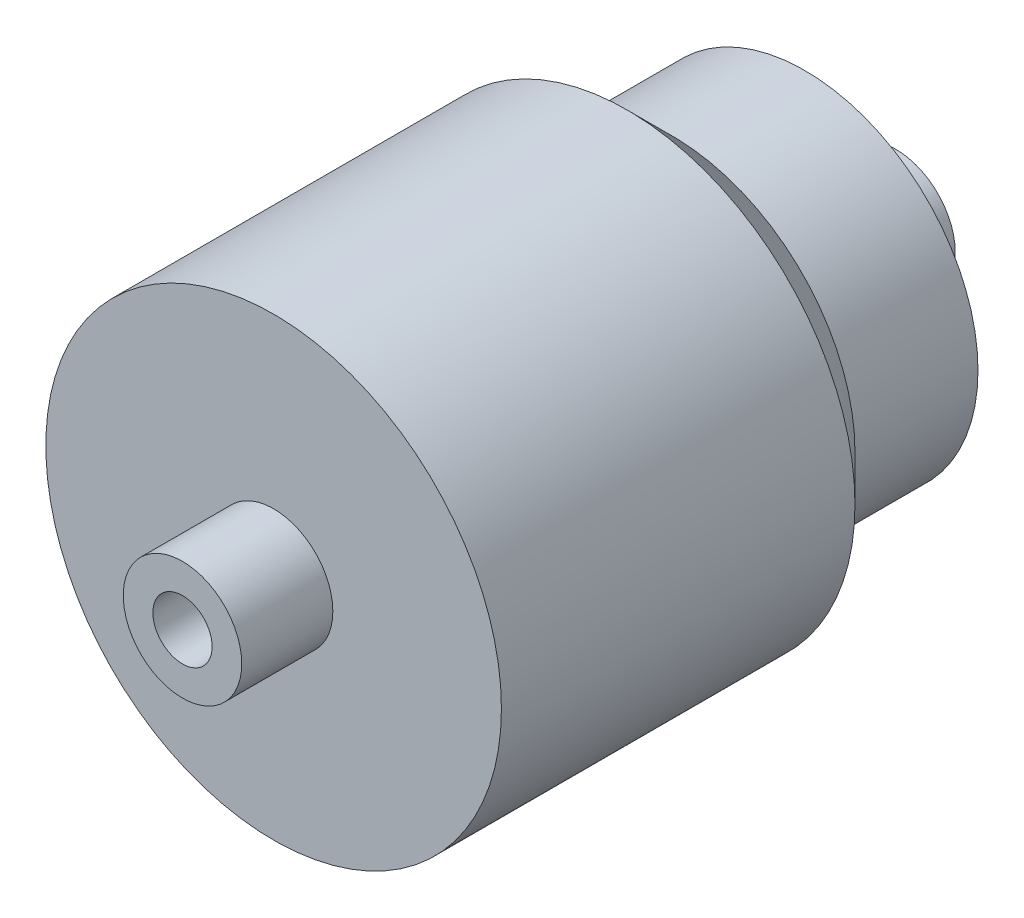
SolidWorks part; units mm, degrees
ref_plane "Спереди" through (0, 0, 0) normal (0, 0, 1) x (1, 0, 0)
ref_plane "Сверху" through (0, 0, 0) normal (0, 1, 0) x (1, 0, 0)
ref_plane "Справа" through (0, 0, 0) normal (1, 0, 0) x (0, 0, -1)
sketch "Эскиз1" plane through (0, 0, 0) normal (1, 0, 0) x (0, 0, -1)
  line L0 (0, 0) -> (76.8131, 0) construction
  line L1 (0, 3.25) -> (78.3, 3.25)
  line L2 (0, 3.25) -> (0, 6.5)
  line L3 (0, 6.5) -> (10, 6.5)
  line L4 (10, 6.5) -> (10, 25)
  line L5 (10, 25) -> (48.8, 25)
  line L6 (48.8, 25) -> (53.8, 20)
  line L7 (53.8, 20) -> (53.8, 19)
  line L8 (53.8, 19) -> (68.3, 19)
  line L9 (68.3, 19) -> (68.3, 6.5)
  line L10 (68.3, 6.5) -> (78.3, 6.5)
  line L11 (78.3, 6.5) -> (78.3, 3.25)
  dimension "D1" = 10
  dimension "D2" = 45
  dimension "D3" = 3.25
  dimension "D4" = 6.5
  dimension "D5" = 19
  dimension "D6" = 25
  dimension "D7" = 20
  dimension "D8" = 58.3
  dimension "D9" = 14.5
revolve "Повернуть1" add sketch "Эскиз1" angle 360 about L0
